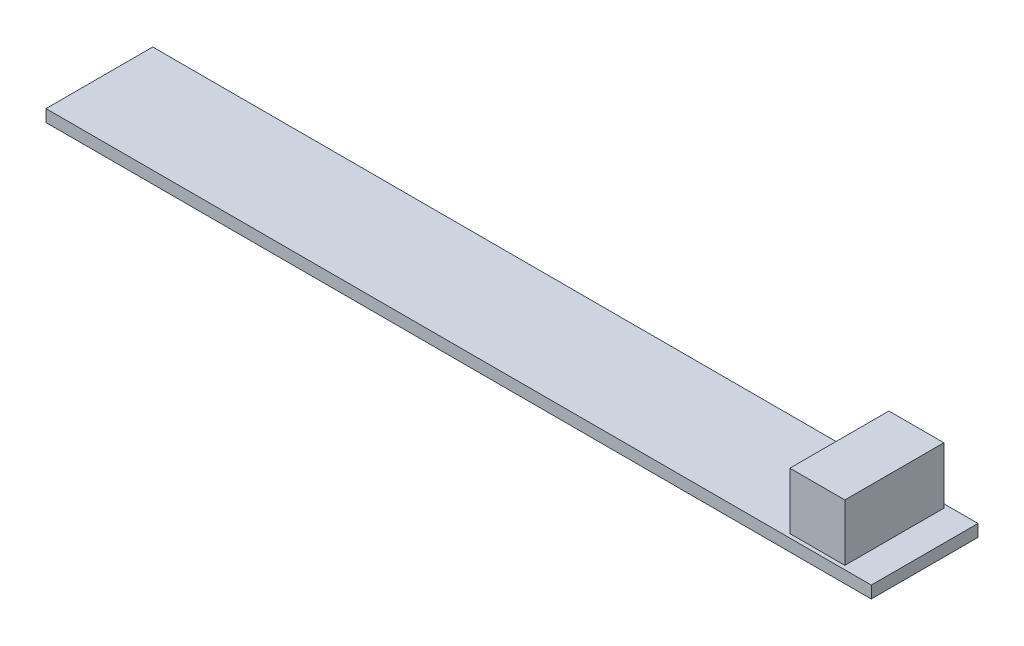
SolidWorks part; units mm, degrees
ref_plane "Front Plane" through (0, 0, 0) normal (0, 0, 1) x (1, 0, 0)
ref_plane "Top Plane" through (0, 0, 0) normal (0, 1, 0) x (1, 0, 0)
ref_plane "Right Plane" through (0, 0, 0) normal (1, 0, 0) x (0, 0, -1)
sketch "Sketch1" plane through (0, 0, 0) normal (0, 1, 0) x (1, 0, 0)
  line L1 (0, 0) -> (76.2, 0)
  line L2 (0, 0) -> (0, 9.8552)
  line L3 (0, 9.8552) -> (76.2, 9.8552)
  line L4 (76.2, 0) -> (76.2, 9.8552)
  dimension "D1" = 9.8552
  dimension "D2" = 76.2
extrude "Boss-Extrude1" add sketch "Sketch1" along normal blind 1.1176
sketch "Sketch2" plane through (0, 1.1176, 0) normal (0, 1, 0) x (1, 0, 0)
  line L1 (68.326, 9.4996) -> (73.406, 9.4996)
  line L2 (68.326, 9.4996) -> (68.326, 0.3556)
  line L3 (68.326, 0.3556) -> (73.406, 0.3556)
  line L4 (73.406, 9.4996) -> (73.406, 0.3556)
  line L6 (76.2, 0) -> (76.2, 9.8552) construction
  line L7 (73.406, 4.9276) -> (76.2, 4.9276) construction
  dimension "D1" = 5.08
  dimension "D2" = 7.874
  dimension "D3" = 9.144
extrude "Boss-Extrude2" add sketch "Sketch2" along normal offset from surface (5.2324 mm away) 6.35
